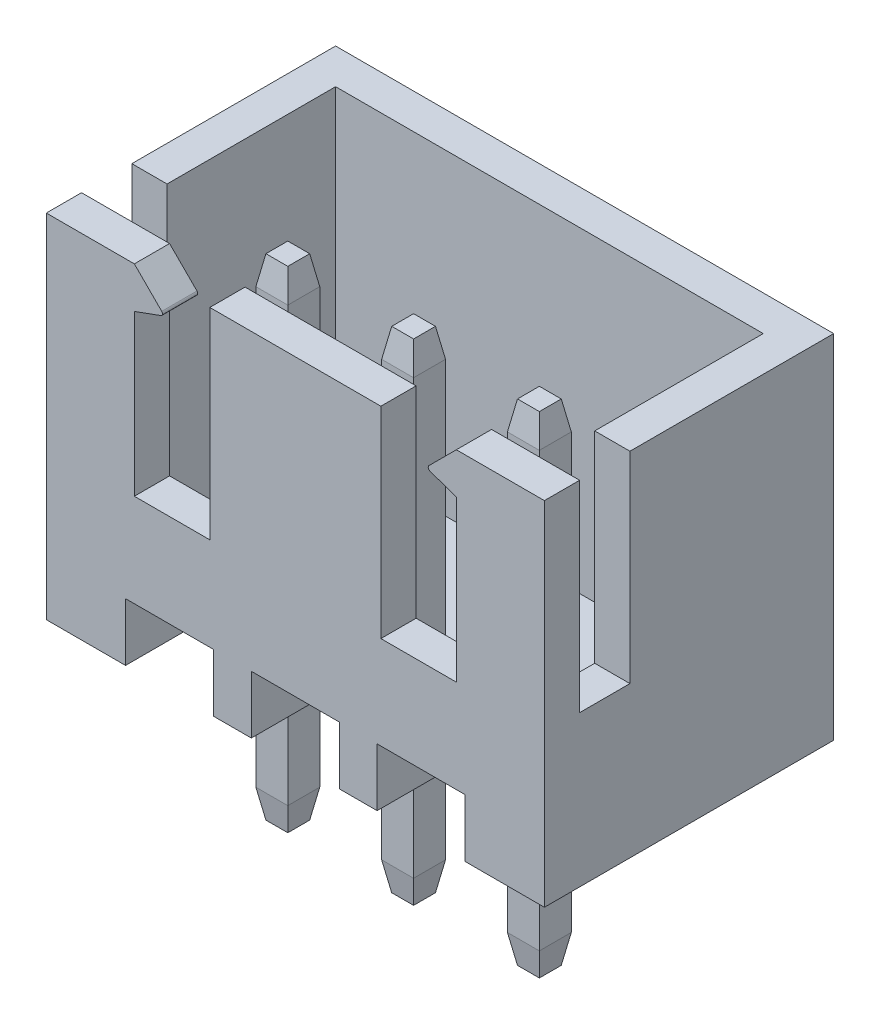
SolidWorks part; units mm, degrees
ref_plane "Front" through (0, 0, 0) normal (0, 0, 1) x (1, 0, 0)
ref_plane "Top" through (0, 0, 0) normal (0, 1, 0) x (1, 0, 0)
ref_plane "Right" through (0, 0, 0) normal (1, 0, 0) x (0, 0, -1)
sketch "Sketch1" plane through (0, 0, 0) normal (0, 1, 0) x (1, 0, 0)
  line L0 (-4.95, 2.875) -> (4.95, -2.875) construction
  line L1 (-4.95, 2.875) -> (4.95, 2.875)
  line L2 (-4.95, 2.875) -> (-4.95, -2.875)
  line L3 (-4.95, -2.875) -> (4.95, -2.875)
  line L4 (4.95, 2.875) -> (4.95, -2.875)
  point P4 (0, 0)
  dimension "D1" = 9.9
  dimension "D2" = 5.75
extrude "X-Y-Z body envelope" add sketch "Sketch1" along normal blind 7
shell "Shell - nom. .6mm thick" thickness 0.7
ref_plane "Plane - Pin offset from CL" through (0, 0, 0) normal (1, 0, 0) x (0, 0, -1)
sketch "Sketch5" plane through (0, 0, 0) normal (1, 0, 0) x (0, 0, -1)
  line L0 (-2.875, 0) -> (2.875, 0) construction
  line L1 (-2.875, 0) -> (2.875, 0)
  line L2 (2.875, 7) -> (2.875, 0) construction
  line L3 (-2.875, 7) -> (-2.875, 0) construction
  line L4 (2.875, 1.15) -> (2.875, 0)
  line L5 (-2.875, 1.15) -> (-2.875, 0)
  line L6 (2.875, 1.15) -> (1.375, 0.1)
  line L7 (1.375, 0.1) -> (-1.375, 0.1)
  line L8 (-1.375, 0.1) -> (-2.875, 1.15)
  dimension "D1" = 0.1
  dimension "D2" = 1.15
  dimension "D3" = 1.5
  dimension "D4" = 1.5
extrude "Body relief" cut sketch "Sketch5" against normal mid plane 1.75
pattern_linear "LPattern2 - Body relief" count 2 spacing 2.5 along (1, 0, 0) count 2 spacing 2.5 along (-1, 0, 0) of "Body relief"
sketch "Sketch2" plane through (0, 0, 2.875) normal (0, 0, 1) x (1, 0, 0)
  line L0 (1.7, 7) -> (1.7, 3)
  line L2 (3.2, 6.1816) -> (3.2, 3)
  line L3 (4.95, 7) -> (4.95, 0) construction
  line L4 (1.7, 3) -> (3.2, 3)
  line L5 (-4.95, 7) -> (4.95, 7) construction
  line L7 (3.2, 6.1816) -> (2.6738, 6.3732)
  line L8 (2.6555, 6.4555) -> (3.2, 7)
  line L10 (1.7, 7) -> (3.2, 7)
  arc A0 (2.6555, 6.4555) -> (2.6738, 6.3732) centre (2.6909, 6.4201) ccw
  point P9 (2.6, 6.4)
  dimension "D7" = 0.05
  dimension "D1" = 1.75
  dimension "D2" = 1.5
  dimension "D3" = 0.6
  dimension "D4" = 4
  dimension "D5" = 45
  dimension "D6" = 110
extrude "Front locking slot" cut sketch "Sketch2" against normal up to surface (0.7 mm away)
mirror "Mirror5" about plane through (0, 0, 0) normal (1, 0, 0) of "Front locking slot"
sketch "Sketch3" plane through (0, 0, 0) normal (0, -1, 0) x (1, 0, 0)
  line L0 (0, 0.8425) -> (0, 0.2075) construction
  line L1 (-0.3175, 0.8425) -> (0.3175, 0.8425)
  line L2 (-0.3175, 0.8425) -> (-0.3175, 0.2075)
  line L3 (-0.3175, 0.2075) -> (0.3175, 0.2075)
  line L4 (0.3175, 0.8425) -> (0.3175, 0.2075)
  line L5 (-0.3175, 0.525) -> (0.3175, 0.525) construction
  line L7 (1.7, 2.875) -> (3.2, 2.875) construction
  dimension "D1" = 0.635
  dimension "D2" = 0.635
  dimension "D4" = 2.35
extrude ".025in Sq. pin" add sketch "Sketch3" along normal blind 3.4 and the other way blind 6.35
chamfer "Chamfer7" distance 0.1 angle 80 8 edges at (-0.3175, 6.35, 0.525) (0, 6.35, 0.2075) (0.3175, 6.35, 0.525) (0, 6.35, 0.8425) (0, -3.4, 0.8425) (0.3175, -3.4, 0.525) (0, -3.4, 0.2075) (-0.3175, -3.4, 0.525)
pattern_linear "LPattern - All pins" count 2 spacing 2.5 along (1, 0, 0) count 2 spacing 2.5 along (-1, 0, 0) of ".025in Sq. pin", "Chamfer7"
sketch "Sketch4" plane through (0, 0, 0) normal (1, 0, 0) x (0, 0, -1)
  line L0 (-2.175, 7) -> (-2.175, 0.7) construction
  line L1 (-2.175, 7) -> (-2.175, 3)
  line L3 (-1.175, 3) -> (-2.175, 3)
  line L4 (2.175, 7) -> (-2.175, 7) construction
  line L6 (-1.175, 7) -> (-2.175, 7)
  line L8 (-1.175, 7) -> (-1.175, 3)
  dimension "D1" = 1
  dimension "D2" = 4
extrude "Side slots" cut sketch "Sketch4" against normal mid plane 20
sketch "Sketch6" plane through (0, 0, 0) normal (0, -1, 0) x (1, 0, 0)
  line L0 (2.1825, 0.2075) -> (2.8175, 0.8425) construction
  circle A0 centre (2.5, 0.525) radius 0.475
  point P2 (2.5, 0.525)
  point P4 (2.5, 0.525)
  dimension "D1" = 0.95
extrude "Pin 1 for .95mm dia. hole" add sketch "Sketch6" along normal blind 1.5
